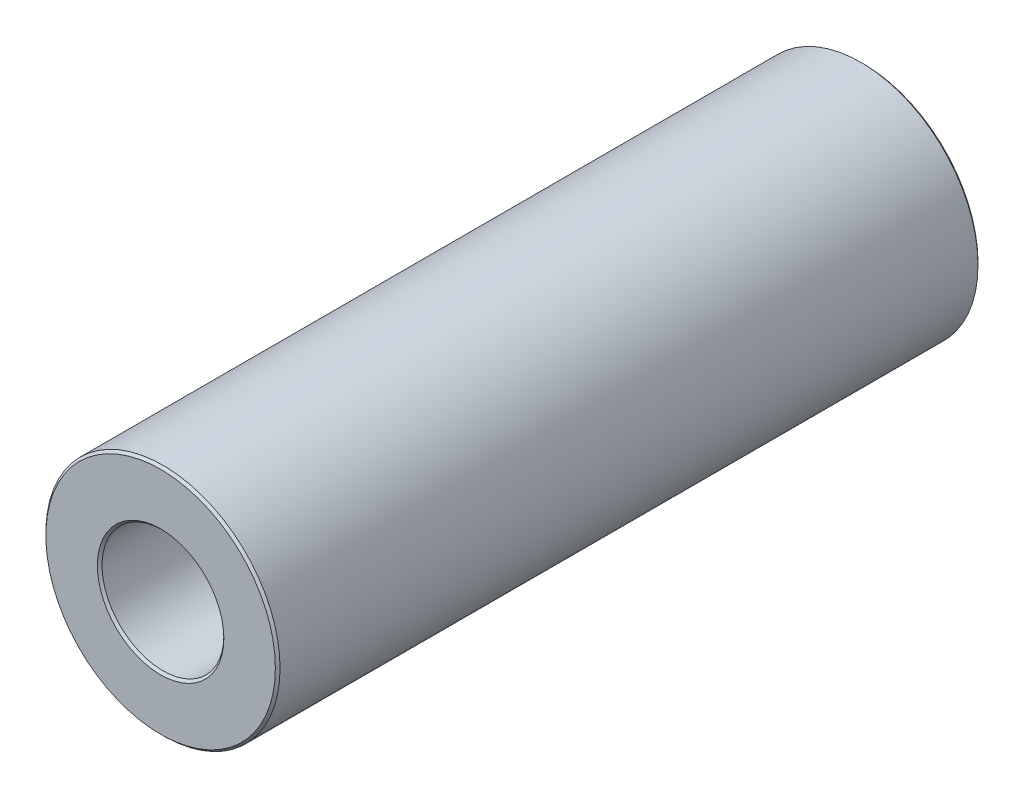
SolidWorks part; units mm, degrees
ref_plane "Front Plane" through (0, 0, 0) normal (0, 0, 1) x (1, 0, 0)
ref_plane "Top Plane" through (0, 0, 0) normal (0, 1, 0) x (1, 0, 0)
ref_plane "Right Plane" through (0, 0, 0) normal (1, 0, 0) x (0, 0, -1)
sketch "Sketch1" plane through (0, 0, 0) normal (0, 0, 1) x (1, 0, 0)
  circle A0 centre (0, 0) radius 5
  circle A1 centre (0, 0) radius 2.6
  dimension "D1" = 10
  dimension "D2" = 5.2
extrude "Boss-Extrude2" add sketch "Sketch1" along normal mid plane 30
chamfer "Chamfer3" distance 0.1 angle 45 4 edges at (5, 0, 15) (5, 0, -15) (2.6, 0, -15) (2.6, 0, 15)
